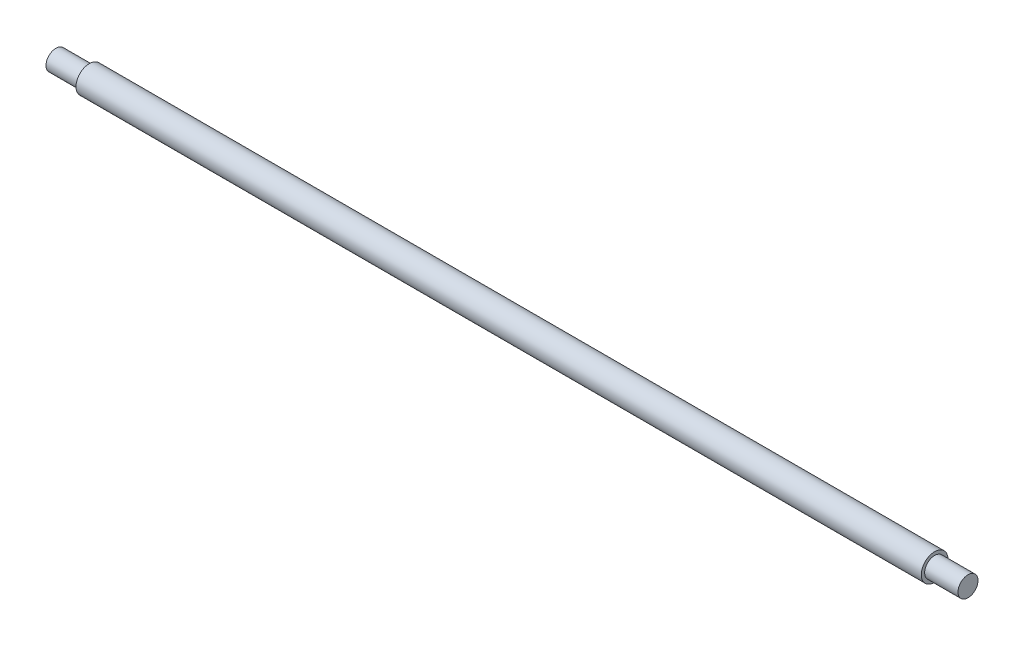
SolidWorks part; units mm, degrees
ref_plane "Plan de face" through (0, 0, 0) normal (0, 0, 1) x (1, 0, 0)
ref_plane "Plan de dessus" through (0, 0, 0) normal (0, 1, 0) x (1, 0, 0)
ref_plane "Plan de droite" through (0, 0, 0) normal (1, 0, 0) x (0, 0, -1)
sketch "Esquisse1" plane through (0, 0, 0) normal (0, 0, 1) x (1, 0, 0)
  line L0 (-136.75, 0) -> (136.75, 0)
  line L1 (136.75, 0) -> (136.75, 3)
  line L2 (136.75, 3) -> (126.75, 3)
  line L3 (126.75, 3) -> (126.75, 4)
  line L4 (126.75, 4) -> (-126.75, 4)
  line L5 (0, 4) -> (0, 0) construction
  line L6 (-126.75, 3) -> (-126.75, 4)
  line L7 (-136.75, 3) -> (-126.75, 3)
  line L8 (-136.75, 0) -> (-136.75, 3)
  dimension "D1" = 3
  dimension "D2" = 4
  dimension "D3" = 126.75
  dimension "D4" = 10
revolve "Révolution1" add sketch "Esquisse1" angle 360 about L0
